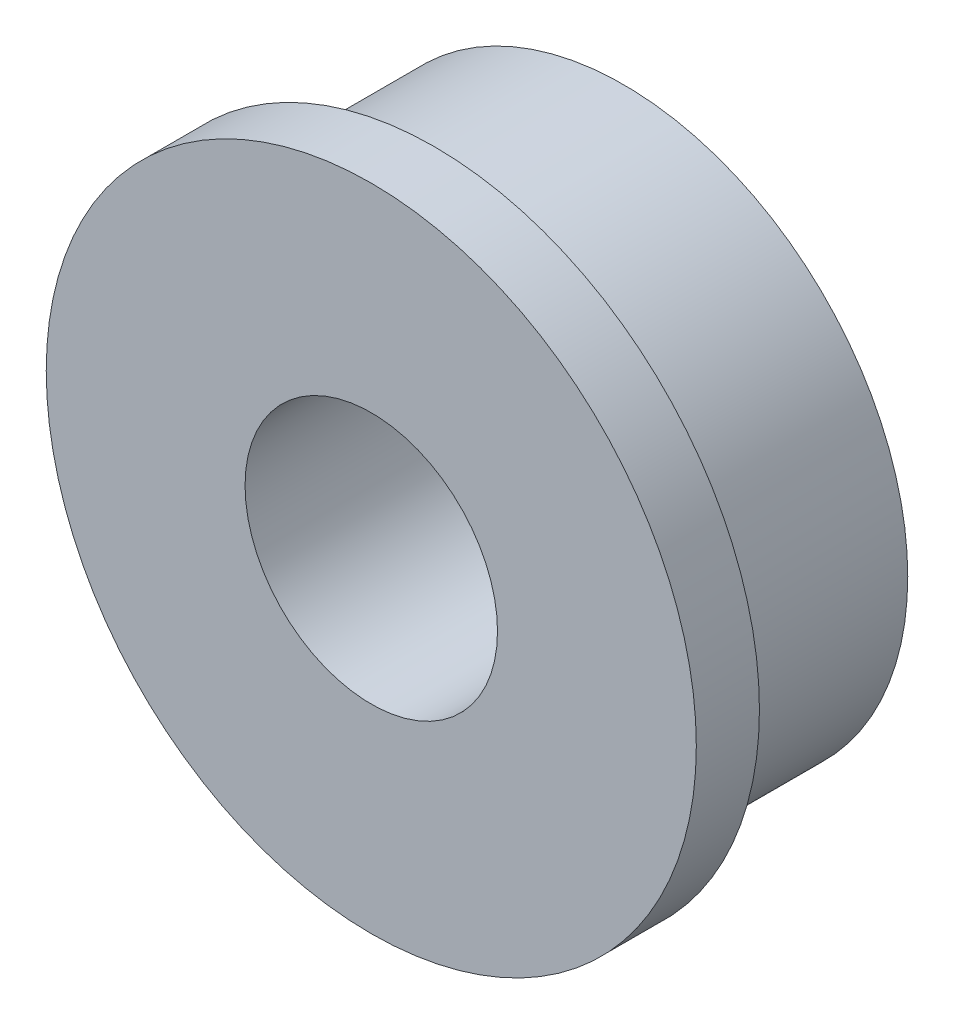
SolidWorks part; units mm, degrees
ref_plane "前视基准面" through (0, 0, 0) normal (0, 0, 1) x (1, 0, 0)
ref_plane "上视基准面" through (0, 0, 0) normal (0, 1, 0) x (1, 0, 0)
ref_plane "右视基准面" through (0, 0, 0) normal (1, 0, 0) x (0, 0, -1)
sketch "草图1" plane through (0, 0, 0) normal (0, 0, 1) x (1, 0, 0)
  circle A0 centre (0, 0) radius 2
  circle A1 centre (0, 0) radius 4.5
  dimension "D1" = 4
  dimension "D2" = 9
extrude "凸台-拉伸1" add sketch "草图1" along normal blind 4
sketch "草图2" plane through (0, 0, 4) normal (0, 0, 1) x (1, 0, 0)
  circle A0 centre (0, 0) radius 5.15
  circle A1 centre (0, 0) radius 4.5 construction
  circle A2 centre (0, 0) radius 4.5
  dimension "D1" = 10.3
extrude "凸台-拉伸2" add sketch "草图2" against normal blind 1
